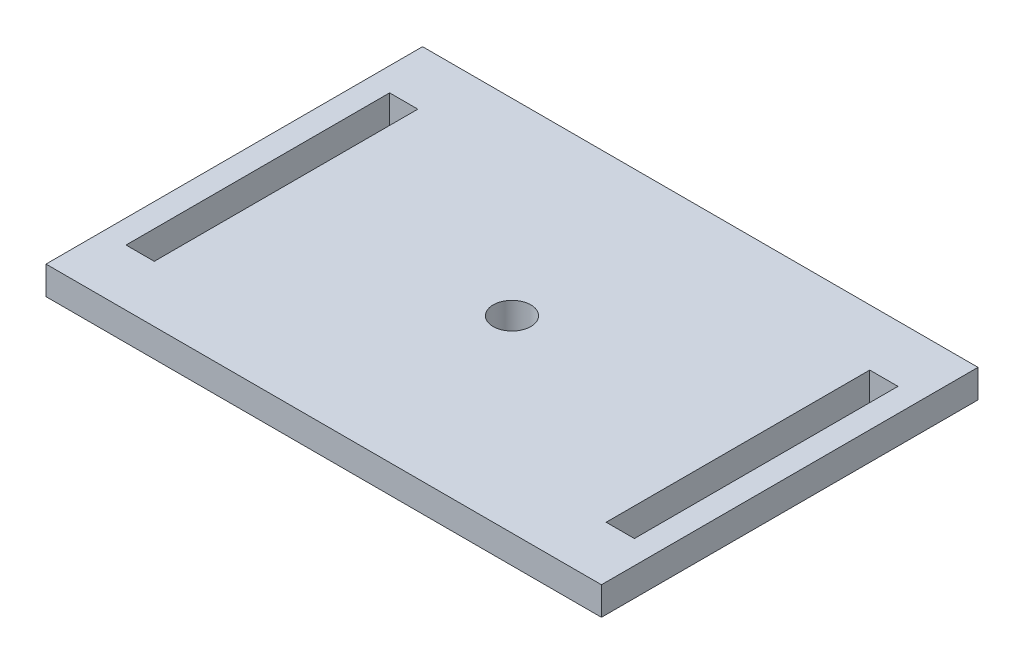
SolidWorks part; units mm, degrees
ref_plane "Front Plane" through (0, 0, 0) normal (0, 0, 1) x (1, 0, 0)
ref_plane "Top Plane" through (0, 0, 0) normal (0, 1, 0) x (1, 0, 0)
ref_plane "Right Plane" through (0, 0, 0) normal (1, 0, 0) x (0, 0, -1)
sketch "Sketch1" plane through (0, 0, 0) normal (0, 1, 0) x (1, 0, 0)
  line L1 (-29.5, 20) -> (29.5, 20)
  line L2 (-29.5, 20) -> (-29.5, -20)
  line L3 (-29.5, -20) -> (29.5, -20)
  line L4 (29.5, 20) -> (29.5, -20)
  line L5 (-29.5, 20) -> (29.5, -20) construction
  line L6 (-29.5, -20) -> (29.5, 20) construction
  circle A0 centre (0, 0) radius 2
  point P0 (0, 0)
  dimension "D3" = 4
  dimension "D1" = 59
  dimension "D2" = 40
extrude "Boss-Extrude1" add sketch "Sketch1" along normal blind 3
sketch "Sketch2" plane through (0, 0, 0) normal (0, 1, 0) x (1, 0, 0)
  line L0 (0, 0) -> (0, 5.3038) construction
  line L1 (0, 0) -> (-25.5, 0) construction
  line L2 (-29.5, 20) -> (-29.5, -20) construction
  line L3 (-27, 14) -> (-24, 14)
  line L4 (-27, 14) -> (-27, -14)
  line L5 (-27, -14) -> (-24, -14)
  line L6 (-24, 14) -> (-24, -14)
  line L7 (-27, 14) -> (-24, -14) construction
  line L8 (-27, -14) -> (-24, 14) construction
  line L9 (29.5, 20) -> (-29.5, 20) construction
  line L10 (27, -14) -> (24, 14) construction
  line L11 (27, 14) -> (24, -14) construction
  line L12 (24, 14) -> (24, -14)
  line L13 (27, -14) -> (24, -14)
  line L14 (27, 14) -> (27, -14)
  line L15 (27, 14) -> (24, 14)
  dimension "D1" = 3
  dimension "D2" = 2.5
  dimension "D3" = 6
extrude "Cut-Extrude1" cut sketch "Sketch2" along normal blind 3
